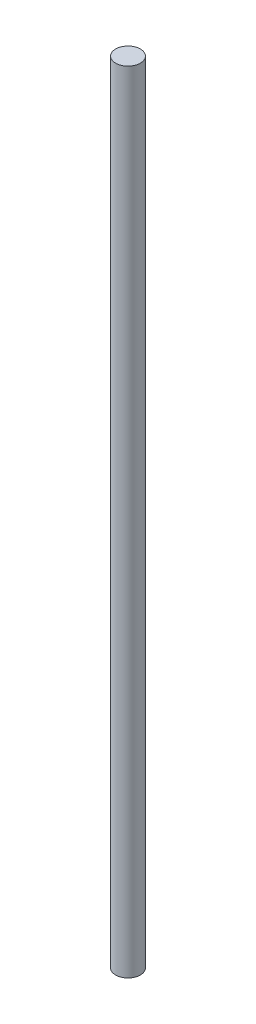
SolidWorks part; units mm, degrees
ref_plane "Front Plane" through (0, 0, 0) normal (0, 0, 1) x (1, 0, 0)
ref_plane "Top Plane" through (0, 0, 0) normal (0, 1, 0) x (1, 0, 0)
ref_plane "Right Plane" through (0, 0, 0) normal (1, 0, 0) x (0, 0, -1)
sketch "Sketch1" plane through (0, 0, 0) normal (0, 1, 0) x (1, 0, 0)
  circle A0 centre (0, 0) radius 2.5
  dimension "D1" = 5
extrude "Boss-Extrude1" add sketch "Sketch1" along normal blind 160
